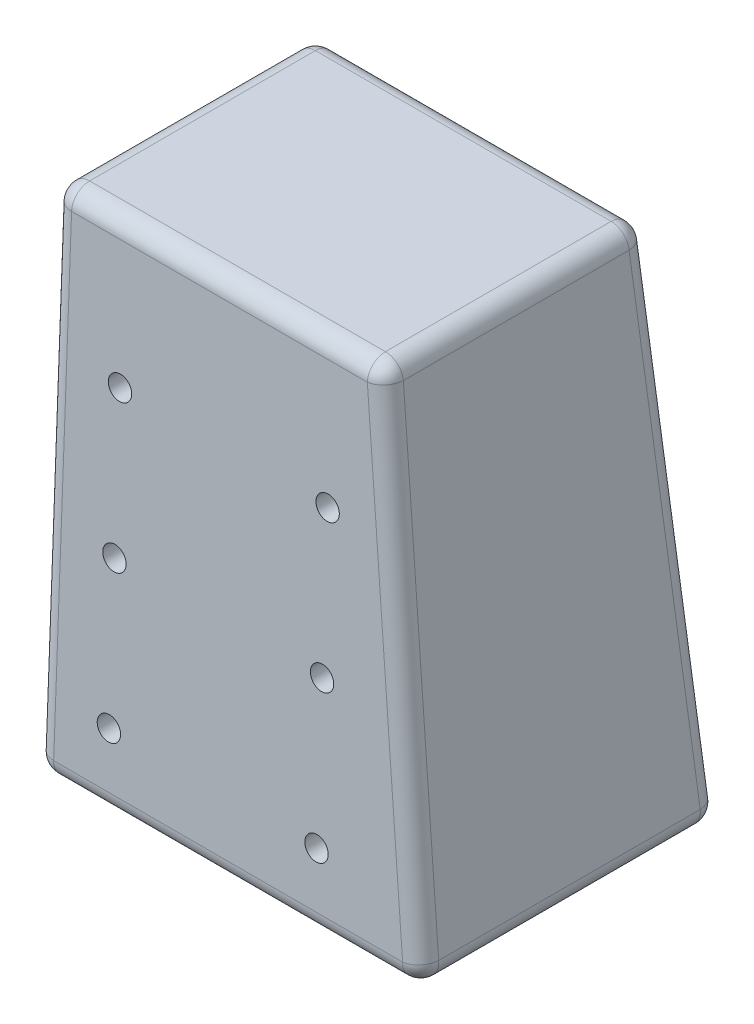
SolidWorks part; units mm, degrees
ref_plane "Front Plane" through (0, 0, 0) normal (0, 0, 1) x (1, 0, 0)
ref_plane "Top Plane" through (0, 0, 0) normal (0, 1, 0) x (1, 0, 0)
ref_plane "Right Plane" through (0, 0, 0) normal (1, 0, 0) x (0, 0, -1)
sketch "Sketch1" plane through (0, 0, 0) normal (0, 1, 0) x (1, 0, 0)
  line L1 (0, 20.679) -> (53.5407, 20.679)
  line L2 (0, 20.679) -> (0, -20.679)
  line L3 (0, -20.679) -> (53.5407, -20.679)
  line L4 (53.5407, 20.679) -> (53.5407, -20.679)
  line B0 (0, 20.679) -> (53.5407, 20.679)
  line B1 (0, 20.679) -> (0, -20.679)
  line B2 (0, -20.679) -> (53.5407, -20.679)
  line B3 (53.5407, 20.679) -> (53.5407, -20.679)
  line B4 (0, 32.5) -> (0, -32.5)
  line B5 (1.5, -34) -> (73.4, -34)
  line B6 (74.9, -32.5) -> (74.9, 32.5)
  line B7 (73.4, 34) -> (1.5, 34)
  line B8 (3, 29.1362) -> (3, 24.8638)
  line B9 (3.15, 24.604) -> (6.85, 22.4678)
  line B10 (7.15, 22.4678) -> (10.85, 24.604)
  line B11 (11, 24.8638) -> (11, 29.1362)
  line B12 (10.85, 29.396) -> (7.15, 31.5322)
  line B13 (6.85, 31.5322) -> (3.15, 29.396)
  line B14 (63.9004, 2.9262) -> (63.9004, -1.3462)
  line B15 (64.0504, -1.606) -> (67.7504, -3.7422)
  line B16 (68.0504, -3.7422) -> (71.7504, -1.606)
  line B17 (71.9004, -1.3462) -> (71.9004, 2.9262)
  line B18 (71.7504, 3.186) -> (68.0504, 5.3222)
  line B19 (67.7504, 5.3222) -> (64.0504, 3.186)
  line B20 (3, -24.8638) -> (3, -29.1362)
  line B21 (3.15, -29.396) -> (6.85, -31.5322)
  line B22 (7.15, -31.5322) -> (10.85, -29.396)
  line B23 (11, -29.1362) -> (11, -24.8638)
  line B24 (10.85, -24.604) -> (7.15, -22.4678)
  line B25 (6.85, -22.4678) -> (3.15, -24.604)
  circle B26 centre (47.4571, 17.0259) radius 1.6
  circle B27 centre (47.4571, -17.0259) radius 1.6
  arc B28 (0, -32.5) -> (1.5, -34) centre (1.5, -32.5) ccw
  arc B29 (73.4, -34) -> (74.9, -32.5) centre (73.4, -32.5) ccw
  arc B30 (74.9, 32.5) -> (73.4, 34) centre (73.4, 32.5) ccw
  arc B31 (1.5, 34) -> (0, 32.5) centre (1.5, 32.5) ccw
  arc B32 (3, 24.8638) -> (3.15, 24.604) centre (3.3, 24.8638) ccw
  arc B33 (6.85, 22.4678) -> (7.15, 22.4678) centre (7, 22.7276) ccw
  arc B34 (10.85, 24.604) -> (11, 24.8638) centre (10.7, 24.8638) ccw
  arc B35 (11, 29.1362) -> (10.85, 29.396) centre (10.7, 29.1362) ccw
  arc B36 (7.15, 31.5322) -> (6.85, 31.5322) centre (7, 31.2724) ccw
  arc B37 (3.15, 29.396) -> (3, 29.1362) centre (3.3, 29.1362) ccw
  arc B38 (63.9004, -1.3462) -> (64.0504, -1.606) centre (64.2004, -1.3462) ccw
  arc B39 (67.7504, -3.7422) -> (68.0504, -3.7422) centre (67.9004, -3.4824) ccw
  arc B40 (71.7504, -1.606) -> (71.9004, -1.3462) centre (71.6004, -1.3462) ccw
  arc B41 (71.9004, 2.9262) -> (71.7504, 3.186) centre (71.6004, 2.9262) ccw
  arc B42 (68.0504, 5.3222) -> (67.7504, 5.3222) centre (67.9004, 5.0624) ccw
  arc B43 (64.0504, 3.186) -> (63.9004, 2.9262) centre (64.2004, 2.9262) ccw
  arc B44 (3, -29.1362) -> (3.15, -29.396) centre (3.3, -29.1362) ccw
  arc B45 (6.85, -31.5322) -> (7.15, -31.5322) centre (7, -31.2724) ccw
  arc B46 (10.85, -29.396) -> (11, -29.1362) centre (10.7, -29.1362) ccw
  arc B47 (11, -24.8638) -> (10.85, -24.604) centre (10.7, -24.8638) ccw
  arc B48 (7.15, -22.4678) -> (6.85, -22.4678) centre (7, -22.7276) ccw
  arc B49 (3.15, -24.604) -> (3, -24.8638) centre (3.3, -24.8638) ccw
sketch_block_instance "loftboty-1"
sketch_block "loftboty"
sketch_block_instance "Block3-1"
sketch_block "Block3"
sketch "Sketch2" plane through (0, 0, 0) normal (1, 0, 0) x (0, 0, -1)
  line B0 (18.0086, 69.5156) -> (18.0086, -0.0154)
  line B1 (18.0086, 69.5156) -> (-18.0086, 69.5156)
  line B2 (-18.0086, 69.5156) -> (-18.0086, -0.0154)
  line B3 (18.0086, -0.0154) -> (-18.0086, -0.0154)
  line B4 (-18.0086, 69.5156) -> (18.0086, 69.5156)
sketch_block_instance "Block-loftxy-2"
sketch_block "Block-loftxy"
sketch_block_instance "Block5-2"
sketch_block "Block5"
ref_plane "Plane1" through (0, 69.5156, 0) normal (0, 1, 0) x (1, 0, 0)
sketch "Sketch3" plane through (0, 69.5156, 0) normal (0, 1, 0) x (1, 0, 0)
  line B0 (0, -18.0086) -> (0, 18.0086)
  line B1 (0, 18.0086) -> (45.6183, 18.0086)
  line B2 (0, 18.0086) -> (0, -18.0086)
  line B3 (0, -18.0086) -> (45.6183, -18.0086)
  line B4 (45.6183, 18.0086) -> (45.6183, -18.0086)
sketch_block_instance "lofttop-1"
sketch_block "lofttop"
sketch "Sketch4" plane through (0, 0, 0) normal (0, 1, 0) x (1, 0, 0)
  line L1 (0, 20.679) -> (53.5407, 20.679)
  line L2 (0, 20.679) -> (0, -20.679)
  line L3 (0, -20.679) -> (53.5407, -20.679)
  line L4 (53.5407, 20.679) -> (53.5407, -20.679)
sketch "Sketch5" plane through (0, 69.5156, 0) normal (0, 1, 0) x (1, 0, 0)
  line L1 (0, 18.0086) -> (53.5407, 18.0086)
  line L2 (0, 18.0086) -> (0, -20.679)
  line L3 (0, -20.679) -> (53.5407, -20.679)
  line L4 (53.5407, 18.0086) -> (53.5407, -20.679)
loft "Loft1" add
fillet "Fillet1" radius 2.5 12 edges
sketch "Sketch6" plane through (0, 0, 0) normal (-1, 0, 0) x (0, 0, 1)
  line L252 (32.5091, 0) -> (-32.4909, 0) construction
  line L253 (-10.3, 0) -> (10.3, 0)
  line L254 (-10.3, 0) -> (-10.3, 60.5846)
  line L255 (-10.3, 60.5846) -> (10.3, 60.5846)
  line L256 (10.3, 0) -> (10.3, 60.5846)
extrude "Cut-Extrude2" cut sketch "Sketch6" against normal blind 42
sketch "Sketch10" plane through (0, 0, -3.8909) normal (0, 0, -1) x (-1, 0, 0)
  line L2 (-42, 7.2326) -> (-42, 12.7682)
  line L4 (-43.387, 67.1115) -> (-50.7396, 2.596)
  line L5 (-50.7396, 2.596) -> (-2.5, 2.596)
  line L6 (-2.5, 2.596) -> (-2.5, 67.1115)
  line L7 (-2.5, 67.1115) -> (-43.387, 67.1115)
  line L8 (-43.387, 67.1115) -> (-50.7396, 2.596)
  line L9 (-50.7396, 2.596) -> (-2.5, 2.596)
  line L10 (-2.5, 2.596) -> (-2.5, 67.1115)
  line L11 (-2.5, 67.1115) -> (-43.387, 67.1115)
  line L12 (56, 7.2326) -> (56, 9.9427)
  line L13 (56, 9.9427) -> (-42, 9.9427)
  line L14 (-42, 9.9427) -> (-42, 7.2326)
  line L15 (-42, 7.2326) -> (56, 7.2326)
  line L16 (56, 7.2326) -> (56, 9.9427)
  line L20 (56, 27.2314) -> (56, 29.9436)
  line L21 (56, 29.9436) -> (-42, 29.9436)
  line L22 (-42, 29.9436) -> (-42, 27.2314)
  line L23 (-42, 27.2314) -> (56, 27.2314)
  line L24 (56, 27.2314) -> (56, 29.9436)
  line L28 (56, 47.2326) -> (56, 49.9423)
  line L29 (56, 49.9423) -> (-42, 49.9423)
  line L30 (-42, 49.9423) -> (-42, 47.2326)
  line L31 (-42, 47.2326) -> (56, 47.2326)
  line L32 (56, 47.2326) -> (56, 49.9423)
  line L36 (56, 30.0591) -> (56, 32.7713)
  line L37 (56, 32.7713) -> (-42, 32.7713)
  line L38 (-42, 32.7713) -> (-42, 30.0591)
  line L39 (-42, 30.0591) -> (56, 30.0591)
  line L40 (56, 30.0591) -> (56, 32.7713)
  line L44 (56, 10.0583) -> (56, 12.7682)
  line L45 (56, 12.7682) -> (-42, 12.7682)
  line L46 (-42, 12.7682) -> (-42, 10.0583)
  line L47 (-42, 10.0583) -> (56, 10.0583)
  line L48 (56, 10.0583) -> (56, 12.7682)
  line L52 (56, 50.0577) -> (56, 52.7674)
  line L53 (56, 52.7674) -> (-42, 52.7674)
  line L54 (-42, 52.7674) -> (-42, 50.0577)
  line L55 (-42, 50.0577) -> (56, 50.0577)
  line L56 (56, 50.0577) -> (56, 52.7674)
  line L60 (-4.369, 7.2326) -> (-4.369, 12.7682)
  line L62 (-42, 27.2314) -> (-42, 32.7713)
  line L64 (-4.369, 27.2314) -> (-4.369, 32.7713)
  line L66 (-42, 47.2326) -> (-42, 52.7674)
  line L68 (-4.369, 47.2326) -> (-4.369, 52.7674)
  circle A0 centre (-38.5547, 30.0014) radius 1.6125
  circle A1 centre (-38.5547, 10.0004) radius 1.6125
  circle A2 centre (-38.5547, 50) radius 1.6125
  circle A3 centre (-9.8516, 50) radius 1.6125
  circle A4 centre (-9.8516, 30.0014) radius 1.6125
  circle A5 centre (-9.8516, 10.0004) radius 1.6125
  dimension "D1" = 0
  dimension "D2" = 0
  dimension "D3" = 0
  dimension "D4" = 0
  dimension "D5" = 0
  dimension "D6" = 0
  dimension "D7" = 0
extrude "Cut-Extrude4" cut sketch "Sketch10" against normal through all and the other way through all contours A0 | A2 | A3 | A4 | A5 | A1
sketch "Sketch7" plane through (0, 69.5156, 0) normal (0, 1, 0) x (1, 0, 0)
  line B0 (0, 18.0086) -> (45.6183, 18.0086)
sketch_block_instance "extrudedepth-1"
sketch_block "extrudedepth"
sketch "Sketch9" plane through (0, 0, 0) normal (-1, 0, 0) x (0, 0, 1)
  line L8 (18.0811, 2.5) -> (15.6028, 67.0156)
  line L9 (15.6028, 67.0156) -> (-15.6028, 67.0156)
  line L10 (-15.6028, 67.0156) -> (-18.0811, 2.5)
  line L11 (-18.0811, 2.5) -> (-10.3, 2.5)
  line L12 (18.0811, 2.5) -> (15.6028, 67.0156)
  line L13 (15.6028, 67.0156) -> (-15.6028, 67.0156)
  line L14 (-15.6028, 67.0156) -> (-18.0811, 2.5)
  line L15 (-18.0811, 2.5) -> (-10.3, 2.5)
  line L16 (-10.3, 2.5) -> (-10.3, 60.5846)
  line L17 (-10.3, 2.5) -> (-10.3, 60.5846)
  line L18 (-10.3, 60.5846) -> (10.3, 60.5846)
  line L19 (-10.3, 60.5846) -> (10.3, 60.5846)
  line L20 (10.3, 60.5846) -> (10.3, 2.5)
  line L21 (10.3, 60.5846) -> (10.3, 2.5)
  line L22 (10.3, 2.5) -> (18.0811, 2.5)
  line L23 (10.3, 2.5) -> (18.0811, 2.5)
  dimension "D1" = 0
